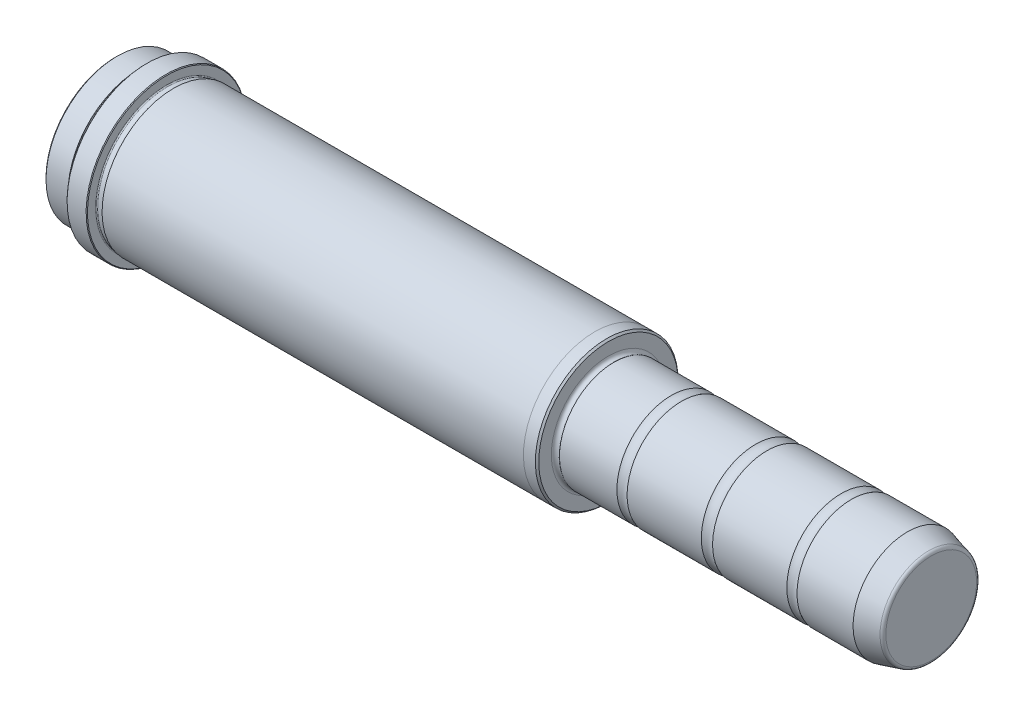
SolidWorks part; units mm, degrees
ref_plane "Front Plane" through (0, 0, 0) normal (0, 0, 1) x (1, 0, 0)
ref_plane "Top Plane" through (0, 0, 0) normal (0, 1, 0) x (1, 0, 0)
ref_plane "Right Plane" through (0, 0, 0) normal (1, 0, 0) x (0, 0, -1)
sketch "Sketch1" plane through (0, 0, 0) normal (0, 0, 1) x (1, 0, 0)
  line L0 (95, 14.1244) -> (88, 16)
  line L1 (88, 16) -> (1.6, 16)
  line L2 (0, 16.8) -> (0, 21)
  line L3 (0, 21) -> (-4, 21)
  line L4 (-128, 21.0001) -> (-128, 20.9)
  line L5 (-128.3, 20.6) -> (-129.7, 20.6)
  line L6 (-130, 20.9) -> (-130, 23.5)
  line L7 (-130, 23.5) -> (-136, 23.5)
  line L8 (-136, 23.5) -> (-136, 20.9)
  line L9 (-136.3, 20.6) -> (-137.7, 20.6)
  line L10 (-138, 20.9) -> (-138, 21)
  line L11 (-138, 21) -> (-145, 21)
  line L12 (-145, 21) -> (-145, 0)
  line L13 (95, 14.1244) -> (95, 0)
  line L14 (95, 0) -> (-95, 0) construction
  line L15 (95, 0) -> (-145, 0)
  line L16 (-4, 21.0001) -> (-128, 21.0001)
  line L17 (-4, 21.0001) -> (-4, 21)
  arc A0 (0, 16.8) -> (1.6, 16) centre (1, 16.8) ccw
  arc A1 (-136, 20.9) -> (-136.3, 20.6) centre (-136.3, 20.9) cw
  arc A2 (-137.7, 20.6) -> (-138, 20.9) centre (-137.7, 20.9) cw
  arc A3 (-129.7, 20.6) -> (-130, 20.9) centre (-129.7, 20.9) cw
  arc A4 (-128, 20.9) -> (-128.3, 20.6) centre (-128.3, 20.9) cw
  point P16 (0, 0)
  point P28 (-130, 20.6)
  point P31 (-128, 20.6)
  dimension "ShoulderRadii" = 2
  dimension "D5" = 0.3
  dimension "D1" = 15
  dimension "D2" = 0.4
  dimension "PinDia" = 32
  dimension "ChamferLeadIn" = 7
  dimension "ShoulderDia" = 42
  dimension "PinLengthN" = 95
  dimension "ShoulderLength" = 136
  dimension "D3" = 0.0001
  dimension "ShoulderGap" = 2
  dimension "D4" = 4
  dimension "T" = 6
  dimension "CollarLength" = 9
  dimension "HeadDia" = 47
  dimension "D8" = 0.2
revolve "Revolve1" add sketch "Sketch1" angle 360 about L14
sketch "Sketch2" plane through (0, 0, 0) normal (0, 0, 1) x (1, 0, 0)
  line L0 (95, -14.1244) -> (95, 14.1244) construction
  line L1 (145.9417, 15.6) -> (148.0583, 15.6) construction
  line L2 (88, 16) -> (1.6, 16) construction
  line L4 (68.5033, 16) -> (71.4967, 16)
  arc A0 (68.5033, 16) -> (71.4967, 16) centre (70, 18.6) ccw
  dimension "GrooveRadius" = 3
  dimension "D3" = 0.4
  dimension "AGroove" = 25
revolve "Groove A" cut sketch "Sketch2" angle 360 about axis through (95, 0, 0) along (1, 0, 0)
sketch "Sketch3" plane through (0, 0, 0) normal (0, 0, 1) x (1, 0, 0)
  line L0 (68.5033, 16) -> (1.6, 16) construction
  line L3 (43.3417, 16) -> (46.6583, 16)
  arc A0 (43.3417, 16) -> (46.6583, 16) centre (45, 18.5) ccw
  arc A1 (68.5033, 16) -> (71.4967, 16) centre (70, 18.6) ccw construction
  dimension "D1" = 0.5
  dimension "GroovePitch" = 25
revolve "Groove B" cut sketch "Sketch3" angle 360 about axis through (95, 0, 0) along (1, 0, 0)
sketch "Sketch4" plane through (0, 0, 0) normal (0, 0, 1) x (1, 0, 0)
  line L2 (43.3417, 16) -> (1.6, 16) construction
  line L3 (18.5033, 16) -> (21.4967, 16)
  arc A0 (18.5033, 16) -> (21.4967, 16) centre (20, 18.6) ccw
  arc A3 (43.3417, 16) -> (46.6583, 16) centre (45, 18.5) ccw construction
  dimension "D1" = 0.4
revolve "Groove C" cut sketch "Sketch4" angle 360 about axis through (95, 0, 0) along (1, 0, 0)
sketch "Sketch5" plane through (0, 0, 0) normal (0, 0, 1) x (1, 0, 0)
  line L0 (-6.4967, 16) -> (-3.5033, 16)
  line L1 (18.5033, 16) -> (1.6, 16) construction
  arc A0 (-6.4967, 16) -> (-3.5033, 16) centre (-5, 18.6) ccw
  arc A3 (18.5033, 16) -> (21.4967, 16) centre (20, 18.6) ccw construction
  dimension "D1" = 0.4
revolve "Groove D" [suppressed] cut sketch "Sketch5" angle 360
fillet "Fillet1" radius 1 1 edges at (95, 14.1244, 0)
chamfer "Chamfer1" distance 0.2 angle 45 2 edges at (-136, 23.5, 0) (-130, 23.5, 0)
chamfer "Chamfer2" distance 0.5 angle 45 2 edges at (-145, 21, 0) (0, 21, 0)
